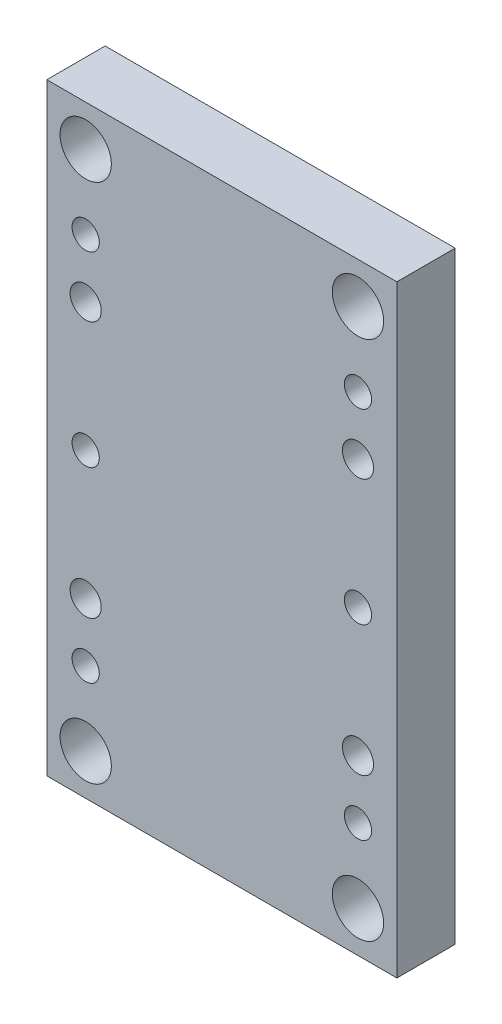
SolidWorks part; units mm, degrees
ref_plane "Plan de face" through (0, 0, 0) normal (0, 0, 1) x (1, 0, 0)
ref_plane "Plan de dessus" through (0, 0, 0) normal (0, 1, 0) x (1, 0, 0)
ref_plane "Plan de droite" through (0, 0, 0) normal (1, 0, 0) x (0, 0, -1)
sketch "Esquisse1" plane through (0, 0, 0) normal (0, 0, 1) x (1, 0, 0)
  line L0 (-45, -78) -> (45, -78)
  line L1 (45, -78) -> (45, 78)
  line L2 (45, 78) -> (-45, 78)
  line L3 (-45, 78) -> (-45, -78)
  line L4 (-35, -89.7182) -> (-35, 88.6791) construction
  line L5 (-57.3691, 0) -> (47.4228, 0) construction
  line L6 (-59.6476, -33) -> (62.5534, -33) construction
  line L7 (-59.6476, 33) -> (56.3599, 33) construction
  line L8 (-59.6476, 48) -> (56.3599, 48) construction
  line L9 (-59.6476, -48) -> (62.5534, -48) construction
  line L10 (35, -99.0045) -> (35, 88.6791) construction
  circle A0 centre (35, 33) radius 4.0038
  circle A1 centre (35, -33) radius 4.0038
  circle A5 centre (35, 67) radius 6.6
  circle A6 centre (35, -67) radius 6.6
  circle A7 centre (-35, -33) radius 4.0038
  circle A8 centre (-35, 33) radius 4.0038
  circle A12 centre (-35, -67) radius 6.6
  circle A13 centre (-35, 67) radius 6.6
  dimension "D1" = 8.0075
  dimension "D2" = 48
  dimension "D3" = 48
  dimension "D4" = 70
extrude "Extrusion1" add sketch "Esquisse1" along normal blind 15
ref_plane "Plan1" through (0, 0, -4) normal (0, 0, 1) x (1, 0, 0)
hole_wizard "Trou taraudé M8x1.01" positions "Esquisse3" profile "Esquisse2" tap size "M8x1.0" standard "Ansi Métrique"
sketch "Esquisse3" plane through (0, 0, 15) normal (0, 0, 1) x (1, 0, 0)
  line L0 (35, -99.0045) -> (35, 88.6791) construction
  line L1 (-35, -89.7182) -> (-35, 88.6791) construction
  line L2 (-59.6476, 48) -> (56.3599, 48) construction
  line L3 (-57.3691, 0) -> (47.4228, 0) construction
  line L4 (-59.6476, -48) -> (62.5534, -48) construction
  line L5 (35, -99.0045) -> (35, 88.6791) construction
  line L6 (-35, -89.7182) -> (-35, 88.6791) construction
  line L7 (-59.6476, 48) -> (56.3599, 48) construction
  line L8 (-57.3691, 0) -> (47.4228, 0) construction
  line L9 (-59.6476, -48) -> (62.5534, -48) construction
  point P0 (-35, 0)
  point P1 (-35, -48)
  point P3 (35, -48)
  point P7 (-35, 48)
  point P9 (35, 48)
  point P11 (35, 0)
sketch "Esquisse2" plane through (-35, 0, 15) normal (1, 0, 0) x (0, -1, 0)
  line L0 (0, 0) -> (0, 15)
  line L1 (0, 15) -> (3.5, 15)
  line L2 (3.5, 15) -> (3.5, 0)
  line L5 (3.5, 0) -> (0, 0)
  line L11 (0, -6.35) -> (0, 107.95) construction
  dimension "Diamètre du trou pour taraudage jusqu'au prochain" = 7
  dimension "Profondeur du trou pour taraudage jusqu'au prochain" = 15
sketch "Esquisse4" plane through (0, 0, 15) normal (0, 0, 1) x (1, 0, 0)
  line L0 (-93.5493, 0) -> (86.0824, 0) construction
  line L1 (-45, 77.5) -> (45, 77.5)
  line L2 (-45, -77.5) -> (45, -77.5)
  line L3 (-45, 78) -> (-45, -78) construction
  line L4 (-45, 77.5) -> (-45, -77.5)
  line L5 (45, -78) -> (45, 78) construction
  line L6 (45, -77.5) -> (45, 77.5)
  circle A0 centre (-35, 67) radius 6.6 construction
  circle A1 centre (-35, -67) radius 6.6 construction
  dimension "D1" = 155
extrude "Enlèv. mat.-Extru.2" cut sketch "Esquisse4" against normal through all flip side to cut
